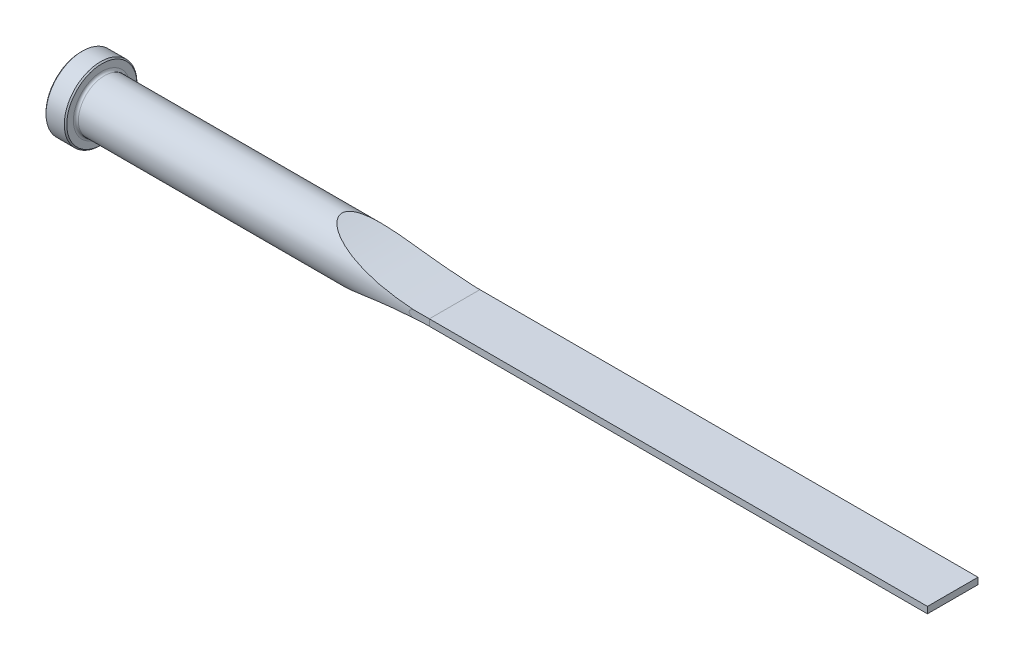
SolidWorks part; units mm, degrees
ref_plane "Front Plane" through (0, 0, 0) normal (0, 0, 1) x (1, 0, 0)
ref_plane "Top Plane" through (0, 0, 0) normal (0, 1, 0) x (1, 0, 0)
ref_plane "Right Plane" through (0, 0, 0) normal (1, 0, 0) x (0, 0, -1)
sketch "Sketch1" plane through (0, 0, 0) normal (0, 0, 1) x (1, 0, 0)
  line L0 (0, 0) -> (175.5286, 0) construction
  line L1 (0, 0) -> (0, 11.1125)
  line L2 (0, 11.1125) -> (6.35, 11.1125)
  line L3 (6.35, 11.1125) -> (6.35, 7.9375)
  line L4 (6.35, 7.9375) -> (266.7, 7.9375)
  line L5 (266.7, 7.9375) -> (266.7, 0)
  line L6 (266.7, 0) -> (0, 0)
  dimension "D1" = 266.7
  dimension "D2" = 22.225
  dimension "D3" = 15.875
  dimension "D4" = 6.35
revolve "Revolve1" add sketch "Sketch1" angle 360 about L0
sketch "Sketch2" plane through (0, 0, 0) normal (0, 0, 1) x (1, 0, 0)
  line L0 (266.7, 7.9375) -> (266.7, 0.9906)
  line L1 (266.7, -7.9375) -> (266.7, 7.9375) construction
  line L2 (266.7, 0.9906) -> (114.3, 0.9906)
  line L3 (266.7, 7.9375) -> (6.35, 7.9375) construction
  line L4 (79.8486, 7.9375) -> (266.7, 7.9375)
  line L5 (166.0833, 0) -> (153.1705, 0) construction
  arc A0 (114.3, 0.9906) -> (79.8486, 7.9375) centre (114.3, 89.8906) cw
  dimension "D1" = 88.9
  dimension "D3" = 152.4
  dimension "D2" = 1.9812
  dimension "D4" = 34.4514
extrude "Cut-Extrude1" cut sketch "Sketch2" against normal through all both and the other way through all
mirror "Mirror1" about plane through (0, 0, 0) normal (0, 1, 0) of "Cut-Extrude1"
sketch "Sketch3" plane through (0, 0, 0) normal (0, 1, 0) x (1, 0, 0)
  line L0 (266.7, 7.9375) -> (266.7, 7.7343)
  line L1 (266.7, 7.8754) -> (266.7, -7.8754) construction
  line L2 (266.7, 7.7343) -> (114.3, 7.7343)
  line L3 (266.7, 7.9375) -> (6.35, 7.9375) construction
  line L4 (108.2927, 7.9375) -> (266.7, 7.9375)
  line L5 (163.4716, 0) -> (166.2513, 0) construction
  line L6 (114.3, 7.8754) -> (114.3, -7.8754) construction
  arc A0 (114.3, 7.7343) -> (108.2927, 7.9375) centre (114.3, 96.6343) cw
  dimension "D2" = 88.9
  dimension "D1" = 15.4686
extrude "Cut-Extrude2" cut sketch "Sketch3" against normal through all both and the other way through all
mirror "Mirror2" about plane through (0, 0, 0) normal (0, 0, 1) of "Cut-Extrude2"
fillet "Fillet1" radius 0.762 1 edges at (6.35, 0, 7.9375)
chamfer "Chamfer1" distance 0.381 angle 45 2 edges at (0, 0, 11.1125) (6.35, 0, 11.1125)
